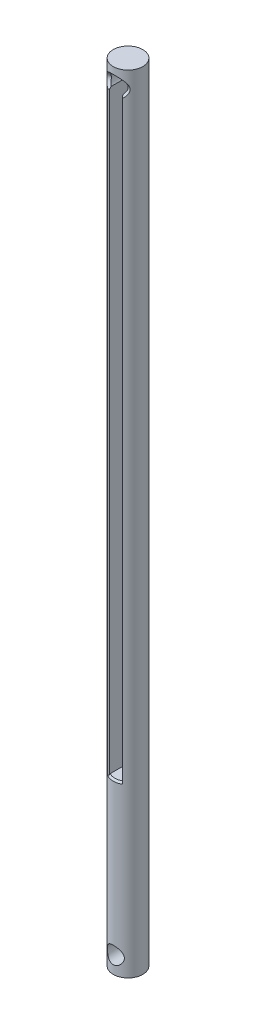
SolidWorks part; units mm, degrees
ref_plane "Front Plane" through (0, 0, 0) normal (0, 0, 1) x (1, 0, 0)
ref_plane "Top Plane" through (0, 0, 0) normal (0, 1, 0) x (1, 0, 0)
ref_plane "Right Plane" through (0, 0, 0) normal (1, 0, 0) x (0, 0, -1)
sketch "Sketch1" plane through (0, 0, 0) normal (0, 1, 0) x (1, 0, 0)
  circle A0 centre (0, 0) radius 2.2178
extrude "Boss-Extrude1" add sketch "Sketch1" along normal mid plane 118.11
sketch "Sketch2" plane through (0, 0, 0) normal (0, 0, 1) x (1, 0, 0)
  line L0 (2.2178, 59.055) -> (-2.2178, 59.055) construction
  line L1 (-2.2178, 59.055) -> (-2.2178, -59.055) construction
  line L2 (2.2178, -59.055) -> (2.2178, 59.055) construction
  line L3 (2.2178, 59.055) -> (-2.2178, 59.055)
  line L4 (-2.2178, 59.055) -> (-2.2178, -59.055)
  line L5 (2.2178, -59.055) -> (2.2178, 59.055)
  line L6 (0, 59.055) -> (0, 0) construction
  line L7 (-0.9525, 55.675) -> (-0.9525, -33.655)
  line L10 (-0.9525, -33.655) -> (0.9525, -33.655)
  line L11 (0.9525, 55.675) -> (0.9525, -33.655)
  arc A0 (0.9525, 55.675) -> (-0.9525, 55.675) centre (0, 56.515) ccw
  dimension "D1" = 2.54
  dimension "D2" = 2.54
  dimension "D3" = 25.4
extrude "Cut-Extrude1" cut sketch "Sketch2" against normal mid plane 25.4
sketch "Sketch3" plane through (0, 0, 0) normal (0, 0, 1) x (1, 0, 0)
  line L0 (-2.2178, -59.055) -> (2.2178, -59.055) construction
  circle A0 centre (0, -56.515) radius 1.27
  dimension "D1" = 2.54
  dimension "D2" = 2.54
extrude "Cut-Extrude2" cut sketch "Sketch3" against normal mid plane 25.4
chamfer "Chamfer1" distance 0.254 angle 45 8 edges at (0, -33.655, 2.2178) (0, -33.655, -2.2178) (-0.054, 55.2462, 2.2172) (-0.002, 55.245, -2.2178) (-0.9525, 11.01, 2.0029) (-0.9525, 11.01, -2.0029) (0.9525, 11.01, -2.0029) (0.9525, 11.01, 2.0029)
